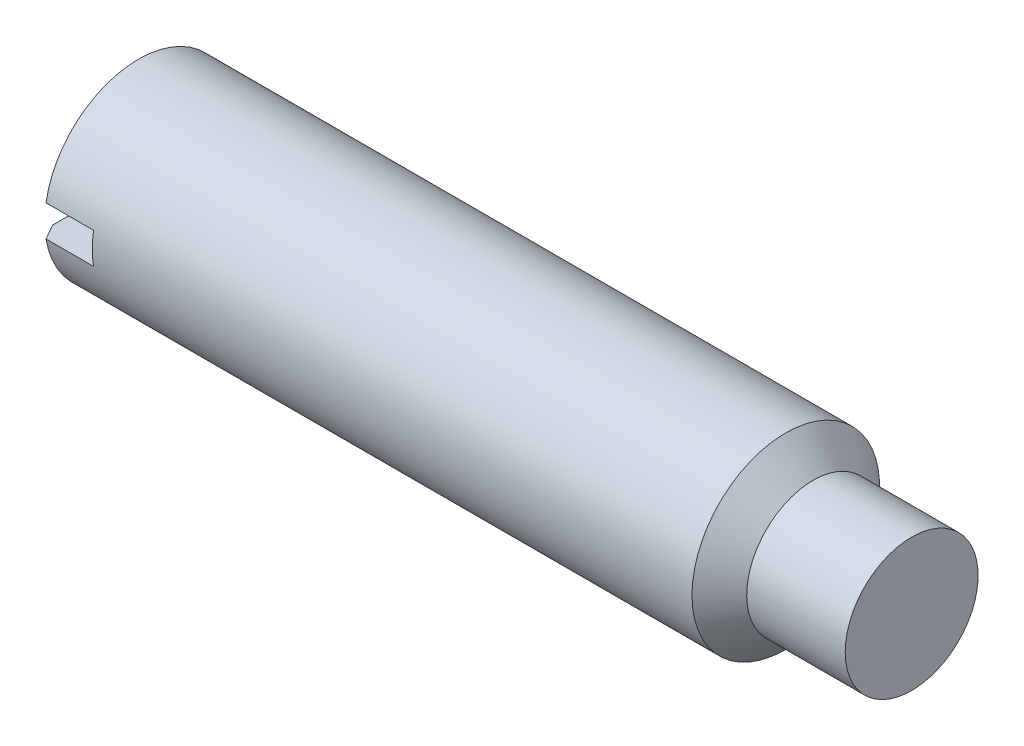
SolidWorks part; units mm, degrees
ref_plane "Plane1" through (0, 0, 0) normal (0, 0, 1) x (1, 0, 0)
ref_plane "Plane2" through (0, 0, 0) normal (0, 1, 0) x (1, 0, 0)
ref_plane "Plane3" through (0, 0, 0) normal (1, 0, 0) x (0, 0, -1)
sketch "BodySke" plane through (0, 0, 0) normal (0, 0, 1) x (1, 0, 0)
  line L0 (0.5566, -6) -> (19.05, -6) construction
  line L1 (43.7, 4.25) -> (50, 4.25)
  line L2 (0.5566, 6) -> (41.95, 6)
  line L3 (43.7, 4.25) -> (41.95, 6)
  line L4 (50, 0) -> (0, 0)
  line L5 (-12.7, 0) -> (88.9, 0) construction
  line L6 (1.75, 12.7) -> (1.75, -6.35) construction
  line L7 (50, 4.25) -> (50, 0)
  line L8 (43.7, -4.25) -> (50, -4.25) construction
  line L9 (0, 0) -> (0, 5.036)
  line L10 (0, 5.036) -> (0.5566, 6)
  dimension "D1" = 45
  dimension "Length" = 50
  dimension "Diameter" = 12
  dimension "Drive_ch_ang" = 60
  dimension "Dog_dia" = 8.5
  dimension "Dog_len" = 6.3
  dimension "Advance" = 1.75
  dimension "Minor_dia" = 10.072
revolve "BaseBody" add sketch "BodySke"
extrude "Slot" cut sketch "Sketch2" along normal blind 3.6
sketch "Sketch2" plane through (0, 0, 0) normal (1, 0, 0) x (0, 0, -1)
  line L1 (6, -1) -> (-6, -1)
  line L2 (6, -1) -> (6, 1)
  line L3 (6, 1) -> (-6, 1)
  line L4 (-6, -1) -> (-6, 1)
  dimension "D1" = 12
  dimension "D2" = 1
  dimension "Slot_width" = 2
  dimension "D3" = 6
sketch "ThdSchSke" plane through (0, 0, 0) normal (0, 0, 1) x (1, 0, 0)
  line L0 (0.5566, -5.036) -> (-0.1184, -6)
  line L1 (0.5566, -5.036) -> (1.2316, -6)
  line L2 (1.2316, -6) -> (1.2316, -7.5)
  line L3 (-3.175, 0) -> (5.1513, 0) construction
  line L5 (1.2316, -7.5) -> (-0.1184, -7.5)
  line L6 (-0.1184, -7.5) -> (-0.1184, -6)
  line L7 (0.5566, -6) -> (0.5566, -1) construction
  dimension "Thread_minor" = 10.072
  dimension "Diameter" = 12
  dimension "SideAngle" = 55
  dimension "VeeAngle" = 70
  dimension "Overcut" = 15
revolve "ThreadSchematic" [suppressed] cut sketch "ThdSchSke" angle 360 about L3
pattern_linear "ThdSchPat" [suppressed]
equation "\"D1@Sketch2\" = \"Diameter@BodySke\""
equation "\"D3@Sketch2\" = \"D1@Sketch2\" / 2"
equation "\"D2@Sketch2\" = \"Slot_width@Sketch2\" / 2"
equation "\"Thread_minor@ThreadCosmetic\" = \"Minor_dia@BodySke\""
equation "\"Thread_minor@ThdSchSke\" = \"Thread_minor@ThreadCosmetic\""
equation "\"Diameter@ThdSchSke\" = \"Diameter@BodySke\""
equation "\"Overcut@ThdSchSke\" = \"Diameter@BodySke\" * 1.25"
equation "\"Num_threads@ThdSchPat\" = int( (\"Length@BodySke\" - ( ( ( \"Diameter@BodySke\" - \"Minor_dia@BodySke\" ) * 0.5 ) / tan( \"Drive_ch_ang@BodySke\" * 0.017453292 ) ) - \"Dog_len@BodySke\" ) / \"Advance@BodySke\" + "
equation "\"Advance@ThdSchPat\" = (\"Length@BodySke\" - ( ( ( \"Diameter@BodySke\" - \"Minor_dia@BodySke\" ) * 0.5 ) / tan( \"Drive_ch_ang@BodySke\" * 0.017453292 ) ) - \"Dog_len@BodySke\" ) /  (\"Num_threads@ThdSchPat\" - 1"
equation "\"Num_threads@ThdSchPat\" = \"Num_threads@ThdSchPat\" - sgn( \"Num_threads@ThdSchPat\" - 1) '---chamfered tips only---"
